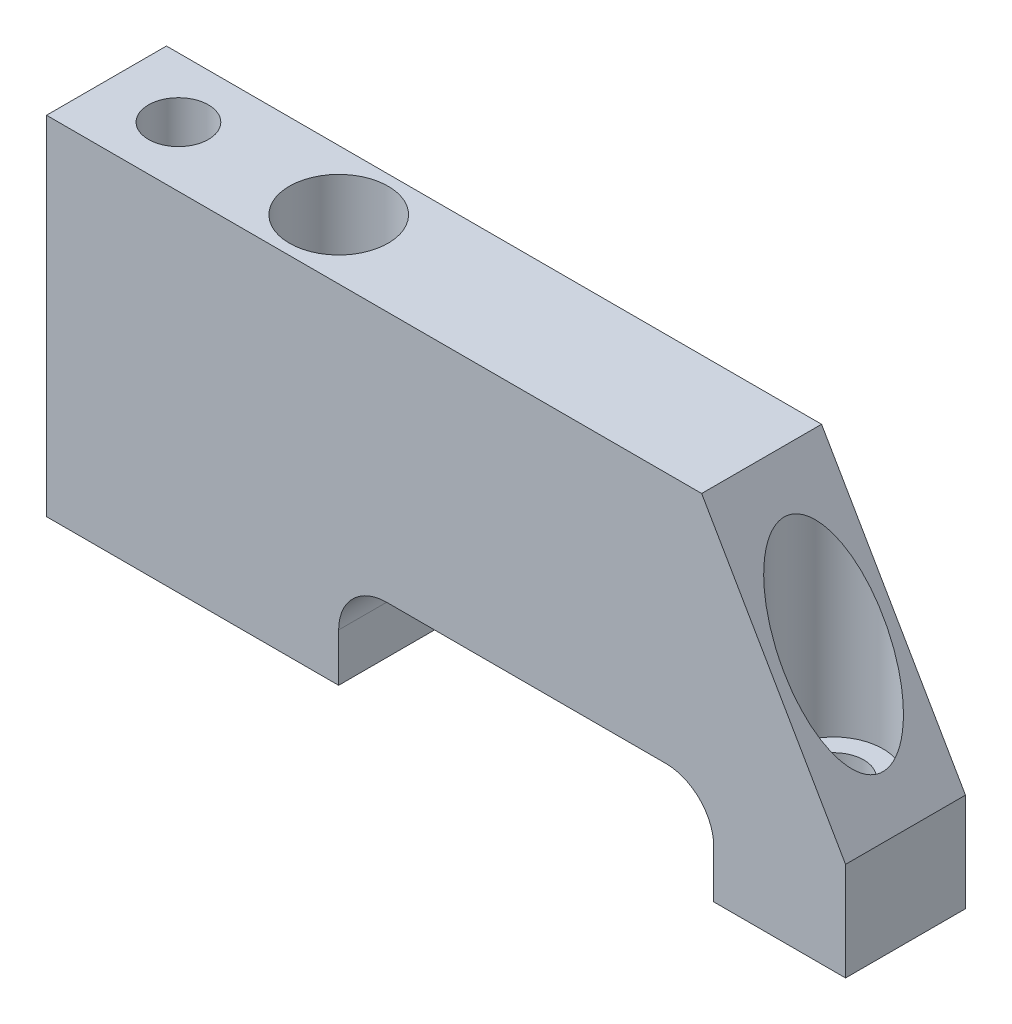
SolidWorks part; units mm, degrees
ref_plane "Front Plane" through (0, 0, 0) normal (0, 0, 1) x (1, 0, 0)
ref_plane "Top Plane" through (0, 0, 0) normal (0, 1, 0) x (1, 0, 0)
ref_plane "Right Plane" through (0, 0, 0) normal (1, 0, 0) x (0, 0, -1)
sketch "Sketch1" plane through (0, 0, 0) normal (0, 0, 1) x (1, 0, 0)
  line L0 (0, 0) -> (42.2783, 0)
  line L1 (42.2783, 0) -> (42.2783, 46.0248)
  line L2 (42.2783, 46.0248) -> (-63.5, 46.0248)
  line L3 (-63.5, 46.0248) -> (-63.5, 0)
  line L4 (-63.5, 0) -> (0, 0)
  line L5 (-32.7533, 0) -> (-32.7533, 46.0248) construction
  line L6 (32.7533, 0) -> (32.7533, 46.0248) construction
  line L7 (0, 0) -> (0, 21.7671) construction
  line L8 (-24.8285, 0) -> (-24.8285, 12.7)
  line L9 (-24.8285, 12.7) -> (24.8285, 12.7)
  line L10 (24.8285, 12.7) -> (24.8285, 0)
  line L11 (-53.975, 46.0248) -> (-53.975, 0) construction
  line L12 (23.2283, 46.0248) -> (42.2783, 13.0292)
  dimension "D1" = 63.5
  dimension "D2" = 46.0248
  dimension "D3" = 65.5066
  dimension "D4" = 9.525
  dimension "D5" = 7.9248
  dimension "D6" = 7.9248
  dimension "D7" = 12.7
  dimension "D8" = 9.525
  dimension "D9" = 30
  dimension "D10" = 19.05
sketch "Sketch2" plane through (0, 0, 0) normal (0, 0, 1) x (1, 0, 0)
  line L0 (-63.5, 0) -> (0, 0) construction
  line L1 (0, 0) -> (42.2783, 0) construction
  line L2 (42.2783, 0) -> (42.2783, 46.0248) construction
  line L3 (42.2783, 46.0248) -> (-63.5, 46.0248) construction
  line L4 (-63.5, 46.0248) -> (-63.5, 0) construction
  line L5 (-63.5, 0) -> (-24.8285, 0)
  line L6 (24.8285, 0) -> (42.2783, 0)
  line L7 (42.2783, 0) -> (42.2783, 46.0248)
  line L8 (42.2783, 46.0248) -> (-63.5, 46.0248)
  line L9 (-63.5, 46.0248) -> (-63.5, 0)
  line L10 (-24.8285, 0) -> (-24.8285, 12.7) construction
  line L11 (-24.8285, 12.7) -> (24.8285, 12.7) construction
  line L12 (24.8285, 12.7) -> (24.8285, 0) construction
  line L13 (-24.8285, 0) -> (-24.8285, 12.7)
  line L14 (-24.8285, 12.7) -> (24.8285, 12.7)
  line L15 (24.8285, 12.7) -> (24.8285, 0)
extrude "Boss-Extrude1" add sketch "Sketch2" along normal mid plane 15.875
fillet "Fillet1" radius 6.35 2 edges at (24.8285, 12.7, 0) (-24.8285, 12.7, 0)
hole_wizard "CBORE for 5/16 Socket Head Cap Screw2" positions "Sketch9" profile "Sketch8" counterbore size "5/16" standard "ANSI Inch"
sketch "Sketch9" plane through (0, 46.0248, 0) normal (0, 1, 0) x (1, 0, 0)
  point P0 (32.7533, 0)
  point P3 (-32.7533, 0)
sketch "Sketch8" plane through (32.7533, 46.0248, 0) normal (1, 0, 0) x (0, 0, 1)
  line L0 (0, 0) -> (0, 46.0248)
  line L1 (0, 46.0248) -> (4.0005, 46.0248)
  line L3 (4.0005, 46.0248) -> (4.0005, 31.75)
  line L4 (4.0005, 31.75) -> (6.5405, 31.75)
  line L5 (6.5405, 31.75) -> (6.5405, 0)
  line L7 (6.5405, 0) -> (0, 0)
  line L11 (0, -6.35) -> (0, 107.95) construction
  dimension "Thru Hole Dia." = 8.001
  dimension "Thru Hole Depth" = 46.0248
  dimension "C'Bore Dia." = 13.081
  dimension "C'Bore Depth" = 31.75
hole_wizard "5/16 (0.3125) Diameter Hole1" positions "Sketch11" profile "Sketch10" hole size "5/16" standard "ANSI Inch"
sketch "Sketch11" plane through (0, 46.0248, 0) normal (0, 1, 0) x (1, 0, 0)
  point P0 (-53.975, 0)
sketch "Sketch10" plane through (-53.975, 46.0248, 0) normal (1, 0, 0) x (0, 0, 1)
  line L0 (0, 0) -> (0, 22.7047)
  line L1 (0, 22.7047) -> (3.9687, 20.32)
  line L2 (3.9687, 20.32) -> (3.9687, 0)
  line L5 (3.9687, 0) -> (0, 0)
  line L10 (0, 22.7047) -> (-3.9688, 20.32) construction
  line L11 (0, -6.35) -> (0, 107.95) construction
  dimension "Hole Dia." = 7.9375
  dimension "Hole Depth" = 20.32
  dimension "Drill Angle" = 118
sketch "Sketch12" plane through (0, 0, 0) normal (0, 0, 1) x (1, 0, 0)
  line L0 (23.2283, 46.0248) -> (42.2783, 13.0292) construction
  line L1 (23.2283, 46.0248) -> (42.2783, 13.0292)
extrude "Cut-Extrude1" cut sketch "Sketch12" against normal through all and the other way through all
